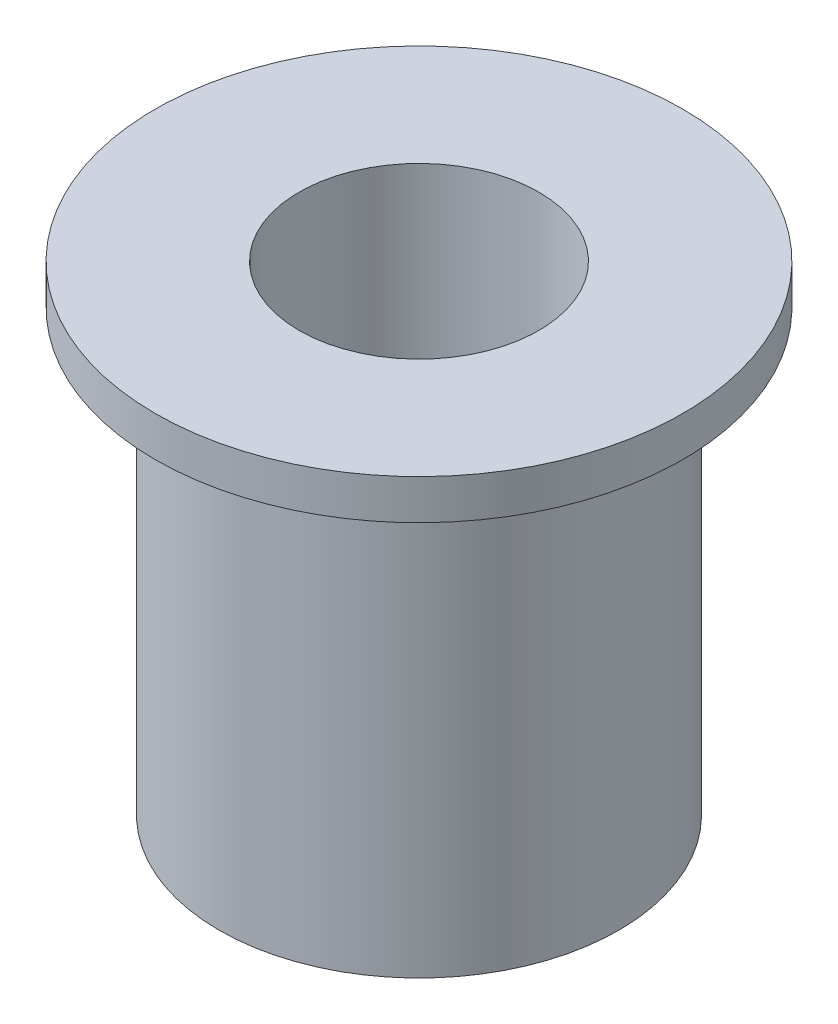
SolidWorks part; units mm, degrees
ref_plane "Front Plane" through (0, 0, 0) normal (0, 0, 1) x (1, 0, 0)
ref_plane "Top Plane" through (0, 0, 0) normal (0, 1, 0) x (1, 0, 0)
ref_plane "Right Plane" through (0, 0, 0) normal (1, 0, 0) x (0, 0, -1)
sketch "Sketch1" plane through (0, 0, 0) normal (0, 1, 0) x (1, 0, 0)
  circle A0 centre (0, 0) radius 7.9375
  circle A1 centre (0, 0) radius 4.7625
  dimension "D1" = 9.525
  dimension "D2" = 15.875
extrude "Extrude1" add sketch "Sketch1" along normal blind 17.4625
sketch "Sketch2" plane through (0, 17.4625, 0) normal (0, 1, 0) x (-1, 0, 0)
  circle A0 centre (0, 0) radius 10.4775
  circle A1 centre (0, 0) radius 4.7625
  dimension "D1" = 20.955
extrude "Extrude2" add sketch "Sketch2" along normal blind 1.5875
